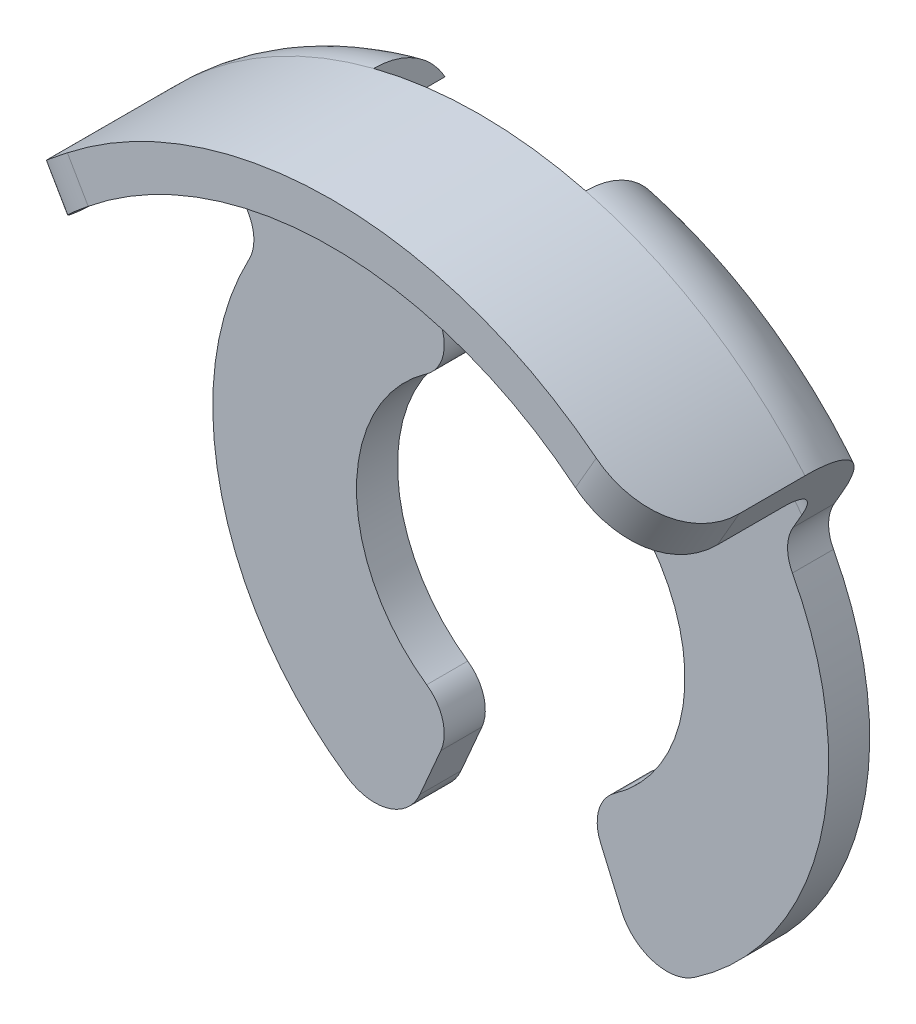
SolidWorks part; units mm, degrees
ref_plane "Front Plane" through (0, 0, 0) normal (0, 0, 1) x (1, 0, 0)
ref_plane "Top Plane" through (0, 0, 0) normal (0, 1, 0) x (1, 0, 0)
ref_plane "Right Plane" through (0, 0, 0) normal (1, 0, 0) x (0, 0, -1)
sketch "Sketch1" plane through (0, 0, 0) normal (0, 0, 1) x (1, 0, 0)
  circle A0 centre (0, 0) radius 2
  circle A1 centre (0, 0) radius 5.2
  dimension "D1" = 4
  dimension "D2" = 10.4
extrude "Boss-Extrude1" add sketch "Sketch1" against normal blind 2.8
sketch "Sketch2" plane through (0, 0, 0) normal (0, 0, 1) x (1, 0, 0)
  circle A0 centre (0, 0) radius 4.7
  dimension "D1" = 9.4
extrude "Cut-Extrude1" cut sketch "Sketch2" against normal blind 2.3
sketch "Sketch3" plane through (0, 0, 0) normal (0, 0, 1) x (1, 0, 0)
  line L0 (-3.9619, 3.368) -> (-3.1721, 2)
  line L1 (3.9619, 3.368) -> (3.1721, 2)
  circle A0 centre (0, 0) radius 5.2 construction
  arc A1 (-3.1721, 2) -> (3.1721, 2) centre (0, 0) ccw
  circle A2 centre (0, 0) radius 2 construction
  arc A4 (-3.9619, 3.368) -> (3.9619, 3.368) centre (0, 0) ccw
  point P7 (-3.75, 0)
  point P9 (3.75, 0)
  point P10 (0, 2)
  dimension "D1" = 60
  dimension "D2" = 7.5
extrude "Cut-Extrude2" cut sketch "Sketch3" against normal through all
sketch "Sketch4" plane through (0, 0, -2.3) normal (0, 0, 1) x (1, 0, 0)
  line L0 (0, 0) -> (-0.794, -1.8356) construction
  line L1 (0, 0) -> (0.794, -1.8356) construction
  line L2 (-0.794, 1.8356) -> (-1.6102, 3.7225)
  line L3 (0, 0) -> (-0.794, 1.8356) construction
  line L4 (0, 0) -> (0.794, 1.8356) construction
  line L5 (1.6102, 3.7225) -> (0.794, 1.8356)
  line L6 (0.794, 1.8356) -> (0.794, -1.8356) construction
  line L7 (-0.794, 1.8356) -> (-0.794, -1.8356) construction
  line L8 (-0.794, -1.8356) -> (-1.2277, -2.8382)
  line L9 (0.794, -1.8356) -> (1.2277, -2.8382)
  arc A0 (1.2145, 4.5404) -> (-1.2145, 4.5404) centre (0, 0) ccw
  arc A1 (3.6947, 2.9051) -> (-3.6947, 2.9051) centre (0, 0) ccw construction
  arc A2 (-0.794, 1.8356) -> (-0.794, -1.8356) centre (0, 0) ccw
  circle A3 centre (0, 0) radius 2 construction
  arc A4 (-1.6102, 3.7225) -> (-1.2145, 4.5404) centre (-1.0595, 3.9607) cw
  arc A6 (1.2145, 4.5404) -> (1.6102, 3.7225) centre (1.0595, 3.9607) cw
  arc A7 (-1.2277, -2.8382) -> (-2.1171, -3.0952) centre (-1.7783, -2.6) cw
  arc A8 (-3.1721, 2) -> (3.1721, 2) centre (0, 0) ccw construction
  arc A9 (1.2277, -2.8382) -> (2.1171, -3.0952) centre (1.7783, -2.6) ccw
  arc A10 (2.1171, -3.0952) -> (-2.1171, -3.0952) centre (0, 0) cw
  arc A11 (3.9619, 3.368) -> (-3.9619, 3.368) centre (0, 0) ccw construction
  arc A12 (0.794, -1.8356) -> (0.794, 1.8356) centre (0, 0) ccw
  point P1 (-1.7783, -3.2)
  point P30 (1.7783, -3.2)
  point P31 (0, 5.2)
  dimension "D2" = 0.6
  dimension "D1" = 8.4
extrude "Cut-Extrude3" cut sketch "Sketch4" against normal up to vertex
fillet "Fillet1" radius 1 3 edges at (0, 5.2, -2.8) (3.8283, 3.1365, 0) (-3.8283, 3.1365, 0)
fillet "Fillet2" radius 0.5 8 edges at (2.5872, 3.9238, -2.3) (-2.5872, 3.9238, -2.3) (-0.794, -1.8356, -2.55) (0.794, -1.8356, -2.55) (-0.794, 1.8356, -2.55) (0.794, 1.8356, -2.55) (-3.1721, 2, -2.55) (3.1721, 2, -2.55)
sketch "Sketch5" plane through (0, -4.5, -2.8) normal (0, 0, 1) x (1, 0, 0)
  line L0 (-1.2913, 7.4854) -> (-1.2913, 9.7)
  line L5 (1.2913, 7.4854) -> (1.2913, 9.7)
  line L6 (1.2913, 7.4854) -> (-1.2913, 7.4854)
  line L7 (0.9724, 6.7482) -> (1.6102, 8.2225) construction
  line L8 (-1.6102, 8.2225) -> (-0.9724, 6.7482) construction
  line L10 (-1.2913, 9.7) -> (1.2913, 9.7)
  arc A0 (3.9619, 7.868) -> (-3.9619, 7.868) centre (0, 4.5) ccw construction
extrude "Cut-Extrude5" cut sketch "Sketch5" along normal blind 1
